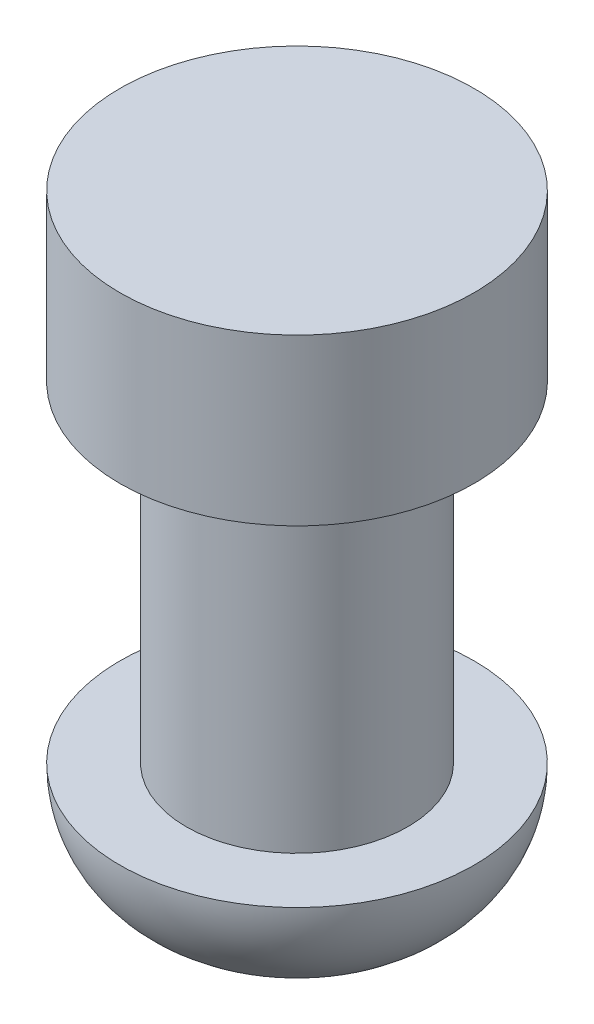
SolidWorks part; units mm, degrees
ref_plane "Front Plane" through (0, 0, 0) normal (0, 0, 1) x (1, 0, 0)
ref_plane "Top Plane" through (0, 0, 0) normal (0, 1, 0) x (1, 0, 0)
ref_plane "Right Plane" through (0, 0, 0) normal (1, 0, 0) x (0, 0, -1)
sketch "Sketch2" plane through (0, 0, 0) normal (0, 1, 0) x (1, 0, 0)
  circle A0 centre (0, 0) radius 1.1906
  dimension "D1" = 2.3813
extrude "Boss-Extrude1" add sketch "Sketch2" along normal blind 3.556
sketch "Sketch3" plane through (0, 3.556, 0) normal (0, 1, 0) x (1, 0, 0)
  circle A0 centre (0, 0) radius 1.905
  dimension "D1" = 3.81
extrude "Boss-Extrude2" add sketch "Sketch3" along normal blind 1.778
sketch "Sketch4" plane through (0, 0, 0) normal (0, -1, 0) x (1, 0, 0)
  circle A0 centre (0, 0) radius 1.905
extrude "Boss-Extrude3" add sketch "Sketch4" along normal blind 1.27
fillet "Fillet2" radius 1.27 1 edges at (0, -1.27, -1.905)
